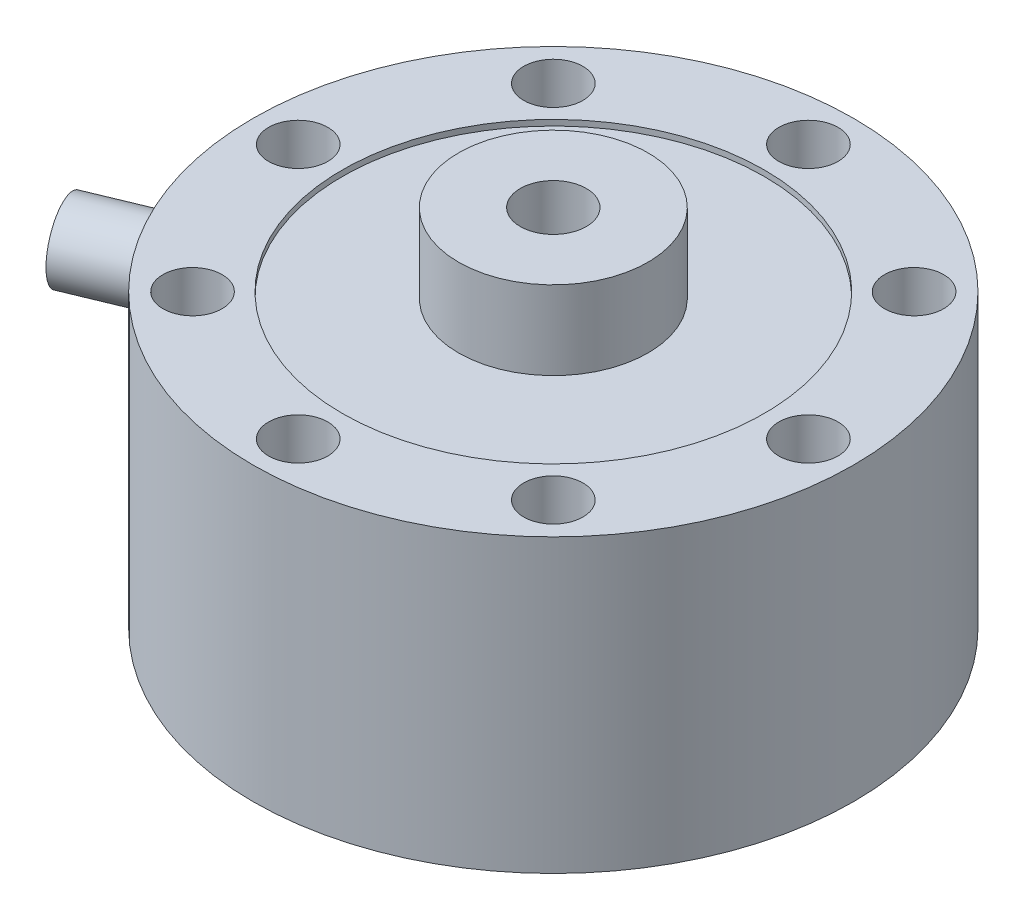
SolidWorks part; units mm, degrees
ref_plane "Front Plane" through (0, 0, 0) normal (0, 0, 1) x (1, 0, 0)
ref_plane "Top Plane" through (0, 0, 0) normal (0, 1, 0) x (1, 0, 0)
ref_plane "Right Plane" through (0, 0, 0) normal (1, 0, 0) x (0, 0, -1)
sketch "Sketch1" plane through (0, 0, 0) normal (0, 1, 0) x (1, 0, 0)
  circle A0 centre (0, 0) radius 52.324
  dimension "D1" = 104.648
extrude "Boss-Extrude1" add sketch "Sketch1" along normal blind 50.8 contours A0
sketch "Sketch2" plane through (0, 50.8, 0) normal (0, 1, 0) x (1, 0, 0)
  circle A0 centre (0, 0) radius 16.51
  dimension "D1" = 33.02
extrude "Boss-Extrude2" add sketch "Sketch2" along normal blind 12.7 contours A0
sketch "Sketch3" plane through (0, 0, 0) normal (0, -1, 0) x (1, 0, 0)
  circle A0 centre (0, 0) radius 16.51
  dimension "D1" = 33.02
extrude "Boss-Extrude3" add sketch "Sketch3" along normal blind 1.27 contours A0
hole_wizard "1/2-20 Tapped Hole1" positions "Sketch5" profile "Sketch4" tap size "1/2-20" standard "ANSI Inch"
sketch "Sketch5" plane through (0, 63.5, 0) normal (0, 1, 0) x (1, 0, 0)
  point P0 (0, 0)
sketch "Sketch4" plane through (0, 63.5, 0) normal (1, 0, 0) x (0, 0, 1)
  line L0 (0, 0) -> (0, 37.4174)
  line L1 (0, 37.4174) -> (5.7544, 33.9598)
  line L2 (5.7544, 33.9598) -> (5.7544, 0)
  line L5 (5.7544, 0) -> (0, 0)
  line L10 (0, 37.4174) -> (-5.7544, 33.9598) construction
  line L11 (0, -6.35) -> (0, 107.95) construction
  dimension "Tap Drill Dia." = 11.5087
  dimension "Tap Drill Depth" = 33.9598
  dimension "Drill Angle" = 118
hole_wizard "1/2-20 Tapped Hole2" positions "Sketch13" profile "Sketch12" tap size "1/2-20" standard "ANSI Inch"
sketch "Sketch13" plane through (0, -1.27, 0) normal (0, -1, 0) x (-1, 0, 0)
  point P0 (0, 0)
sketch "Sketch12" plane through (0, -1.27, 0) normal (1, 0, 0) x (0, 0, -1)
  line L0 (0, 0) -> (0, 24.2856)
  line L1 (0, 24.2856) -> (5.7544, 20.828)
  line L2 (5.7544, 20.828) -> (5.7544, 0)
  line L5 (5.7544, 0) -> (0, 0)
  line L10 (0, 24.2856) -> (-5.7544, 20.828) construction
  line L11 (0, -6.35) -> (0, 107.95) construction
  dimension "Tap Drill Dia." = 11.5087
  dimension "Tap Drill Depth" = 20.828
  dimension "Drill Angle" = 118
sketch "Sketch18" plane through (0, 50.8, 0) normal (0, 1, 0) x (1, 0, 0)
  line L0 (0, 0) -> (0, 87.1456) construction
  circle A0 centre (0, 0) radius 44.45 construction
  circle A1 centre (0, 44.45) radius 3.5941
  dimension "D1" = 88.9
  dimension "D2" = 7.1882
extrude "Cut-Extrude2" cut sketch "Sketch18" against normal through all
sketch "Sketch19" plane through (0, 50.8, 0) normal (0, 1, 0) x (1, 0, 0)
  circle A0 centre (0, 44.45) radius 5.1562
  dimension "D1" = 10.3124
extrude "Cut-Extrude3" cut sketch "Sketch19" against normal blind 7.62
pattern_circular "CirPattern1" count 8 over 360 about axis through (0, 0, 0) along (0, 1, 0) of "Cut-Extrude2", "Cut-Extrude3"
sketch "Sketch20" plane through (0, 50.8, 0) normal (0, 1, 0) x (1, 0, 0)
  circle A0 centre (0, 0) radius 16.51
  circle A1 centre (0, 0) radius 36.7636
  circle A2 centre (0, 0) radius 16.51 construction
  dimension "D1" = 0
extrude "Cut-Extrude4" cut sketch "Sketch20" against normal blind 1
sketch "Sketch21" plane through (0, 50.8, 0) normal (0, 1, 0) x (1, 0, 0)
  line L0 (0, 0) -> (-97.5167, 0) construction
  line L1 (0, 0) -> (-104.1507, -43.1406) construction
  line L2 (-66.9193, 24.8284) -> (-33.5409, -55.7542) construction
  dimension "D1" = 22.5
  dimension "D2" = 90
  dimension "D3" = 52.324
ref_plane "Plane1" through (-48.3411, 0, 20.0235) normal (-0.9239, 0, 0.3827) x (0.3827, 0, 0.9239)
sketch "Sketch22" plane through (-48.3411, 0, 20.0235) normal (-0.9239, 0, 0.3827) x (0.3827, 0, 0.9239)
  circle A0 centre (0, 41.0197) radius 6.35
  point P2 (0, 47.073)
  point P3 (0, 41.0197)
  dimension "D1" = 12.7
extrude "Boss-Extrude4" add sketch "Sketch22" along normal blind 12.7 and the other way up to surface
